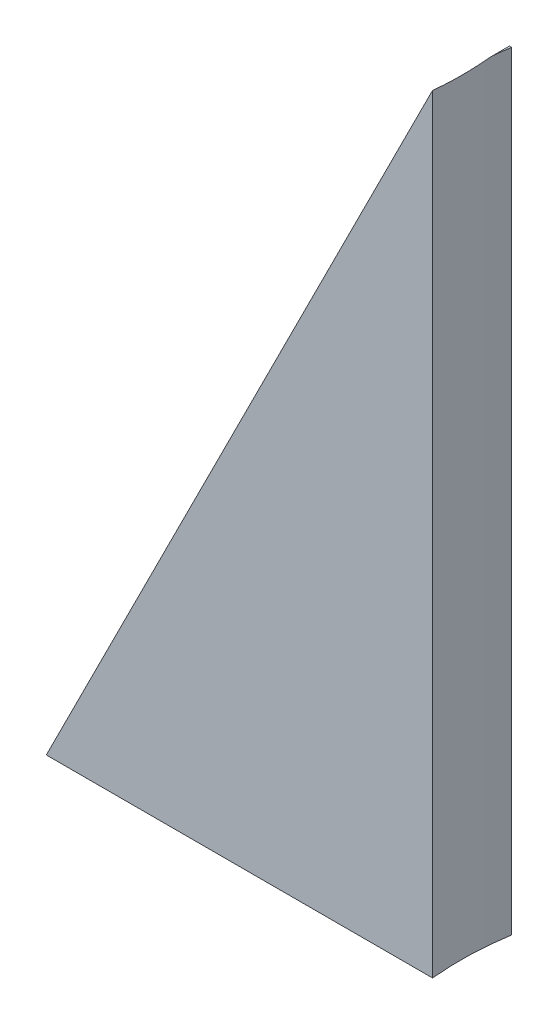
SolidWorks part; units mm, degrees
ref_plane "Plan de face" through (0, 0, 0) normal (0, 0, 1) x (1, 0, 0)
ref_plane "Plan de dessus" through (0, 0, 0) normal (0, 1, 0) x (1, 0, 0)
ref_plane "Plan de droite" through (0, 0, 0) normal (1, 0, 0) x (0, 0, -1)
sketch "Esquisse1" plane through (0, 0, 0) normal (0, 1, 0) x (1, 0, 0)
  line L0 (-50, 10) -> (51.0871, 10)
  line L1 (-50, -10) -> (50.5013, -10)
  line L4 (-50, -10) -> (-50, 10)
  circle A0 centre (127.6128, -2.25) radius 77.5
  point P0 (0, 0)
  dimension "D3" = 155
  dimension "D1" = 20
extrude "Boss.-Extru.1" add sketch "Esquisse1" along normal blind 200 contours A0 L0 L4 L1
sketch "Esquisse2" plane through (0, 0, 10) normal (0, 0, 1) x (1, 0, 0)
  line L0 (-50, 0) -> (50.5013, 200)
  line L2 (-50, 200) -> (50.5013, 200)
  line L3 (-50, 200) -> (-50, 0)
  line L4 (-50, 0) -> (50.5013, 0)
  line L5 (50.5013, 200) -> (50.5013, 0)
extrude "Enlèv. mat.-Extru.1" cut sketch "Esquisse2" against normal blind 200 contours L0 M4 M3
